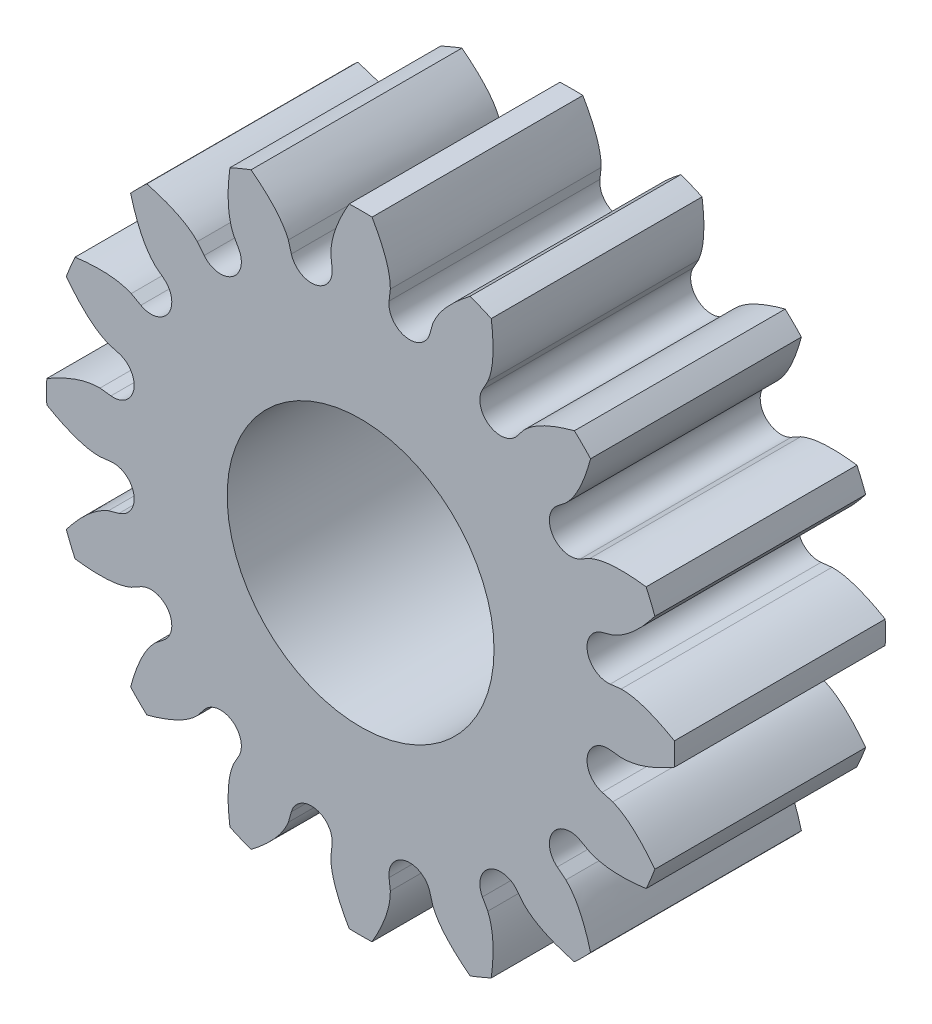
SolidWorks part; units mm, degrees
ref_plane "Front Plane" through (0, 0, 0) normal (0, 0, 1) x (1, 0, 0)
ref_plane "Top Plane" through (0, 0, 0) normal (0, 1, 0) x (1, 0, 0)
ref_plane "Right Plane" through (0, 0, 0) normal (1, 0, 0) x (0, 0, -1)
sketch "Involute construction sketch" plane through (0, 0, 0) normal (0, 0, 1) x (1, 0, 0)
  line L0 (0, 0) -> (-1.7884, 3.29) construction
  line L1 (0, 0) -> (-1.0853, 3.5839) construction
  line L2 (0, 0) -> (-0.3374, 3.7294) construction
  line L3 (0, 0) -> (0.4246, 3.7205) construction
  line L4 (-2.9462, 2.3113) -> (-2.4174, 2.8599) construction
  line L5 (-2.4174, 2.8599) -> (-1.7884, 3.29) construction
  line L6 (-1.7884, 3.29) -> (-1.0853, 3.5839) construction
  line L7 (0, 0) -> (-2.4174, 2.8599) construction
  line L8 (0, 0) -> (-2.9462, 2.3113) construction
  line L9 (-1.0853, 3.5839) -> (-0.3374, 3.7294) construction
  line L10 (-0.3374, 3.7294) -> (0.4246, 3.7205) construction
  line L11 (-2.9462, 2.3113) -> (-0.5946, 5.309) construction
  line L12 (-2.4174, 2.8599) -> (-0.0895, 4.8275) construction
  line L13 (-1.7884, 3.29) -> (0.2201, 4.3818) construction
  line L14 (-1.0853, 3.5839) -> (0.3732, 4.0256) construction
  line L15 (-0.3374, 3.7294) -> (0.4215, 3.7981) construction
  line L17 (0, 0) -> (0, 5.7859) construction
  line L18 (0, 0) -> (0.3906, 3.9658) construction
  line L19 (0, 0) -> (0.6442, 3.2386) construction
  circle A0 centre (0, 0) radius 3.302 construction
  circle A1 centre (0, 0) radius 3.7447 construction
  circle A2 centre (0, 0) radius 3.985 construction
  circle A3 centre (0, 0) radius 4.4831 construction
  spline S0 degree 3 poles (0.4246, 3.7205) (0.4261, 3.8242) (0.3767, 4.0544) (0.1137, 4.6484) (-0.2724, 5.0543) (-0.5946, 5.309) knots 0 0 0 0 0.160054 0.360046 1 1 1 1 construction
  point P17 (0.1633, 4.4801)
sketch "Sketch2" plane through (0, 0, 0) normal (0, 0, 1) x (1, 0, 0)
  line L0 (0, 4.4831) -> (0, 3.302)
  line L1 (0, 0) -> (0, 5.7859) construction
  line L2 (0.4246, 3.7205) -> (0.4067, 3.564)
  line L3 (0, 0) -> (0.4246, 3.7205) construction
  circle A0 centre (0, 0) radius 4.4831 construction
  circle A1 centre (0, 0) radius 3.302 construction
  arc A2 (0, 4.4831) -> (0.1633, 4.4801) centre (0, 0) cw
  arc A3 (0, 3.302) -> (0.6442, 3.2386) centre (0, 0) cw
  arc A4 (0.4067, 3.564) -> (0.6442, 3.2386) centre (0.7022, 3.5302) ccw
  spline S0 degree 3 poles (0.4246, 3.7205) (0.4258, 3.8034) (0.3801, 4.0726) (0.2566, 4.3168) (0.1633, 4.4801) knots 0 0 0 0 0.305961 1 1 1 1
sketch "Sketch3" plane through (0, 0, 0) normal (0, 0, 1) x (1, 0, 0)
  circle A0 centre (0, 0) radius 3.302
  circle A1 centre (0, 0) radius 1.905
extrude "Base" add sketch "Sketch3" along normal blind 3.0099
extrude "Half tooth" add sketch "Sketch2" along normal up to surface (3.0099 mm away)
ref_plane "Midplane of half tooth" through (0, 0, 0) normal (-1, 0, 0) x (0, 0, 1)
mirror "Mirror of half tooth" about plane through (0, 0, 0) normal (-1, 0, 0) of "Half tooth"
pattern_circular "Pattern of tooth" count 16 over 360 of "Half tooth", "Mirror of half tooth"
equation "\"radtodeg\"= 180 / PI'radian to degree conversion [ ]"
equation "\"phi\"= 20'pressure angle [deg]"
equation "\"N\"= 16'number of teeth [teeth]"
equation "\"A\"= 0.353in'diameter of addendum circle [inch]"
equation "\"B\"= 0.260in'diameter of dedendum circle [inch]"
equation "\"P\"= ( \"N\" + 2 ) / \"A\"'diametral pitch [teeth/inch]"
equation "\"d\"= \"N\" / \"P\"'diameter of pitch circle [inch]"
equation "\"cp\"= PI / \"P\"'circular pitch [inch/teeth]"
equation "\"add\"= 1 / \"P\"'addendum [inch]"
equation "\"ded\"= - ( \"B\" - \"d\" ) / 2'dedendum [inch]"
equation "\"clear\"= \"ded\" - \"add\"'clearance [inch]"
equation "\"C\"= \"B\" + 2 * \"clear\"'diameter of clearance circle [inch]"
equation "\"h\"= \"add\" + \"ded\"'tooth height / whole depth [inch]"
equation "\"s\"= \"d\" * cos ( \"phi\" * 1 / \"radtodeg\" )'diameter of base circle [inch]"
equation "\"t\"= ( PI / 2 ) / \"P\"'tooth width at diameter of pitch circle diameter [inch]"
equation "\"alpha\"= ( \"t\" / ( \"d\" / 2 ) * \"radtodeg\" ) / 2'arc angle for half of tooth width at pitch circle diameter [inch]"
equation "\"bore\"= 0.15'bore of hub [inch]"
equation "\"D4@Involute construction sketch\"= \"A\"'addendum circle"
equation "\"D3@Involute construction sketch\"= \"d\"'pitch circle"
equation "\"D2@Involute construction sketch\"= \"s\"'base circle"
equation "\"D1@Involute construction sketch\"= \"B\"'dedendum circle"
equation "\"seg\"= \"D5@Involute construction sketch\"'size of one involute segment [inch]"
equation "\"D6@Involute construction sketch\"=2*\"seg\""
equation "\"D7@Involute construction sketch\"=3*\"seg\""
equation "\"D8@Involute construction sketch\"=4*\"seg\""
equation "\"D9@Involute construction sketch\"=5*\"seg\""
equation "\"D10@Involute construction sketch\"=\"alpha\""
equation "\"D11@Involute construction sketch\"=2*\"alpha\""
equation "\"D1@Sketch3\"=\"B\""
equation "\"D2@Sketch3\"=\"bore\""
